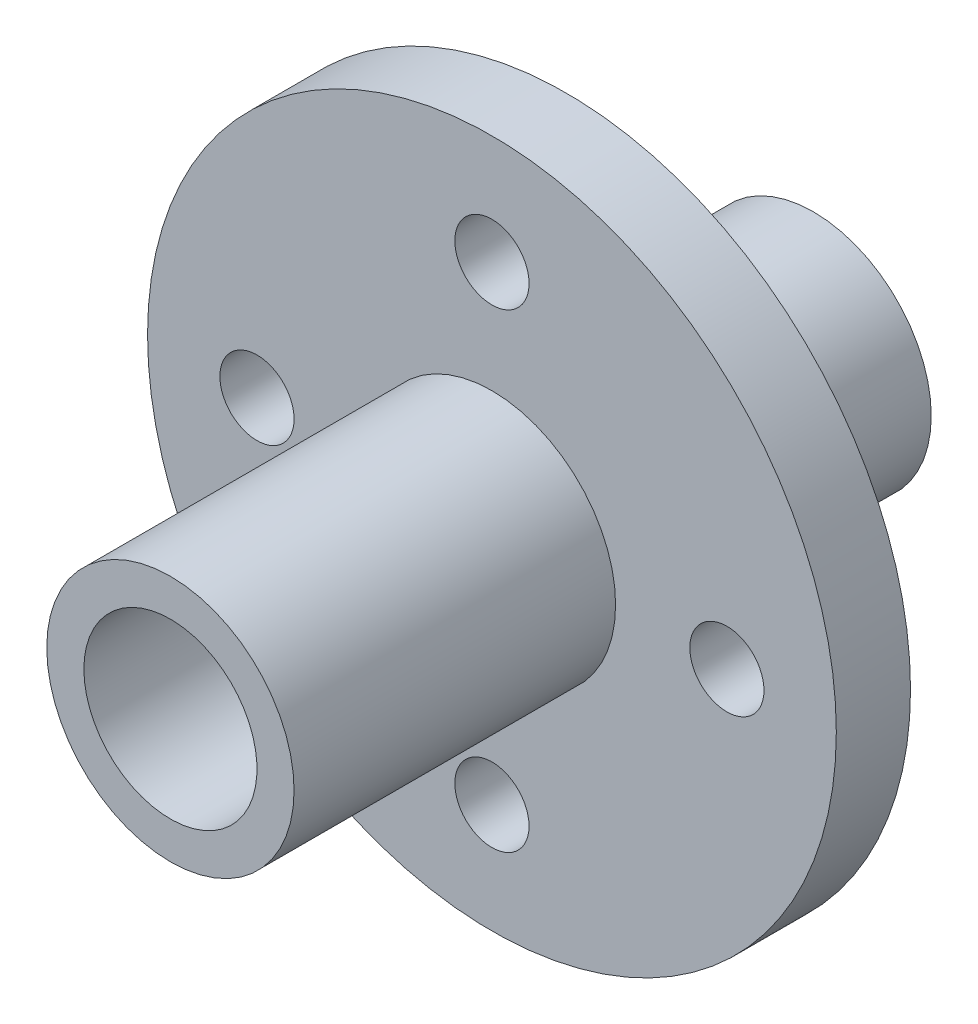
SolidWorks part; units mm, degrees
ref_plane "Front Plane" through (0, 0, 0) normal (0, 0, 1) x (1, 0, 0)
ref_plane "Top Plane" through (0, 0, 0) normal (0, 1, 0) x (1, 0, 0)
ref_plane "Right Plane" through (0, 0, 0) normal (1, 0, 0) x (0, 0, -1)
sketch "Sketch1" plane through (0, 0, 0) normal (0, 0, 1) x (1, 0, 0)
  circle A0 centre (0, 0) radius 13.925
  dimension "D1" = 27.85
extrude "Boss-Extrude1" add sketch "Sketch1" along normal blind 3
sketch "Sketch2" plane through (0, 0, 3) normal (0, 0, 1) x (1, 0, 0)
  circle A0 centre (0, 0) radius 3.5
  circle A1 centre (0, 0) radius 5
  dimension "D1" = 7
  dimension "D2" = 10
extrude "Boss-Extrude2" add sketch "Sketch2" along normal blind 13
sketch "Sketch3" plane through (0, 0, 0) normal (0, 0, -1) x (-1, 0, 0)
  circle A0 centre (0, 0) radius 4.7625
  circle A1 centre (0, 0) radius 3.5
  dimension "D1" = 9.525
  dimension "D2" = 7
extrude "Boss-Extrude3" add sketch "Sketch3" along normal blind 10
sketch "Sketch4" plane through (0, 0, 0) normal (0, 0, -1) x (-1, 0, 0)
  circle A0 centre (0, 0) radius 3.5 construction
  circle A1 centre (0, 0) radius 3.5
extrude "Cut-Extrude1" cut sketch "Sketch4" against normal through all both and the other way through all
sketch "Sketch5" plane through (0, 0, 0) normal (0, 0, -1) x (-1, 0, 0)
  line L0 (-11.6683, 0) -> (10.5846, 0) construction
  line L1 (0, 9.3654) -> (0, -8.3177) construction
  circle A0 centre (-9.5, 0) radius 1.5
  circle A1 centre (0, -9.5) radius 1.5
  circle A2 centre (9.5, 0) radius 1.5
  circle A3 centre (0, 9.5) radius 1.5
  point P13 (0, 0)
  point P14 (0, 0)
  dimension "D3" = 3
  dimension "D4" = 3
  dimension "D5" = 3
  dimension "D6" = 3
  dimension "D1" = 19
  dimension "D2" = 19
extrude "Cut-Extrude2" cut sketch "Sketch5" against normal through all both and the other way through all
